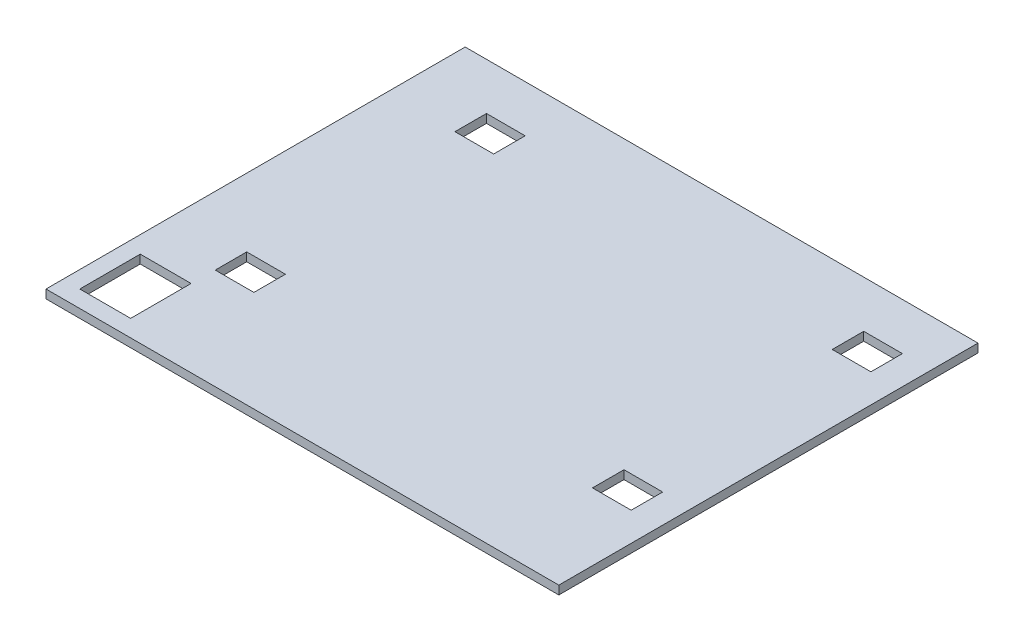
SolidWorks part; units mm, degrees
ref_plane "Front Plane" through (0, 0, 0) normal (0, 0, 1) x (1, 0, 0)
ref_plane "Top Plane" through (0, 0, 0) normal (0, 1, 0) x (1, 0, 0)
ref_plane "Right Plane" through (0, 0, 0) normal (1, 0, 0) x (0, 0, -1)
sketch "Sketch1" plane through (0, 0, 0) normal (0, 1, 0) x (1, 0, 0)
  line L1 (175, -175) -> (-175, -175)
  line L2 (175, -175) -> (175, 175)
  line L3 (175, 175) -> (-175, 175)
  line L4 (-175, -175) -> (-175, 175)
  line L5 (175, -175) -> (-175, 175) construction
  line L6 (175, 175) -> (-175, -175) construction
  point P0 (0, 0)
  dimension "D1" = 350
  dimension "D2" = 350
extrude "Boss-Extrude1" add sketch "Sketch1" along normal blind 6.35
sketch "Sketch2" plane through (0, 6.35, 0) normal (0, 1, 0) x (1, 0, 0)
  line L1 (100, -100) -> (-100, -100) construction
  line L2 (100, -100) -> (100, 100) construction
  line L3 (100, 100) -> (-100, 100) construction
  line L4 (-100, -100) -> (-100, 100) construction
  line L5 (100, -100) -> (-100, 100) construction
  line L6 (100, 100) -> (-100, -100) construction
  line L7 (-150, 95) -> (-75, 95) construction
  line L8 (-150, 95) -> (-150, 82.3) construction
  line L9 (-150, 82.3) -> (-75, 82.3) construction
  line L10 (-75, 95) -> (-75, 82.3) construction
  line L11 (-153.5, 100) -> (-125.5, 100) construction
  line L12 (-153.5, 100) -> (-153.5, 77.3) construction
  line L13 (-153.5, 77.3) -> (-125.5, 77.3) construction
  line L14 (-125.5, 100) -> (-125.5, 77.3) construction
  line L28 (-153.8, 100.3) -> (-125.2, 100.3)
  line L29 (-125.2, 100.3) -> (-125.2, 77)
  line L30 (-153.8, 77) -> (-125.2, 77)
  line L31 (-153.8, 100.3) -> (-153.8, 77)
  line L32 (-55, 0) -> (55, 0) construction
  line L33 (-153.8, -77) -> (-125.2, -77)
  line L34 (-125.2, -100.3) -> (-125.2, -77)
  line L35 (-153.8, -100.3) -> (-125.2, -100.3)
  line L36 (-153.8, -100.3) -> (-153.8, -77)
  line L37 (0, -55) -> (0, 55) construction
  line L38 (153.8, 100.3) -> (153.8, 77)
  line L39 (153.8, 100.3) -> (125.2, 100.3)
  line L40 (125.2, 100.3) -> (125.2, 77)
  line L41 (153.8, 77) -> (125.2, 77)
  line L42 (153.8, -100.3) -> (153.8, -77)
  line L43 (153.8, -100.3) -> (125.2, -100.3)
  line L44 (125.2, -100.3) -> (125.2, -77)
  line L45 (153.8, -77) -> (125.2, -77)
  circle A0 centre (-90.5, 88.65) radius 2 construction
  circle A1 centre (-80.5, 88.65) radius 2 construction
  circle A2 centre (-144.5, 88.65) radius 3 construction
  circle A3 centre (-134.5, 88.65) radius 3 construction
  point P0 (0, 0)
  point P16 (-150, 88.65)
  point P17 (-112.5, 95)
  point P25 (-139.5, 100)
  point P26 (-131.5, 88.65)
  point P27 (-147.5, 88.65)
  dimension "D8" = 4
  dimension "D10" = 4
  dimension "D13" = 6
  dimension "D14" = 6
  dimension "D1" = 200
  dimension "D2" = 200
  dimension "D3" = 75
  dimension "D4" = 12.7
  dimension "D5" = 5
  dimension "D6" = 9.5
  dimension "D7" = 22
  dimension "D9" = 32
  dimension "D11" = 22
  dimension "D12" = 32
  dimension "D15" = 5
  dimension "D16" = 6
  dimension "D17" = 6
  dimension "D18" = 0.3
extrude "Cut-Extrude1" cut sketch "Sketch2" against normal blind 10
sketch "Sketch3" plane through (0, 6.35, 0) normal (0, 1, 0) x (1, 0, 0)
  line L0 (-140.15, -117.8) -> (-140.15, -162.5) construction
  line L1 (100, -100) -> (-100, -100) construction
  line L2 (100, -100) -> (100, 100) construction
  line L3 (100, 100) -> (-100, 100) construction
  line L4 (-100, -100) -> (-100, 100) construction
  line L5 (100, -100) -> (-100, 100) construction
  line L6 (100, 100) -> (-100, -100) construction
  line L7 (-191.75, -117.8) -> (-154.15, -117.8)
  line L8 (-191.75, -117.8) -> (-191.75, -162.5)
  line L9 (-191.75, -162.5) -> (-154.15, -162.5)
  line L10 (-154.15, -117.8) -> (-154.15, -162.5)
  line L11 (-191.75, -117.8) -> (-154.15, -162.5) construction
  line L12 (-191.75, -162.5) -> (-154.15, -117.8) construction
  line L13 (-175, -175) -> (175, -175) construction
  line L14 (-175, 175) -> (-175, -175) construction
  point P0 (0, 0)
  point P6 (-172.95, -140.15)
  point P11 (-140.15, -140.15)
  dimension "D1" = 200
  dimension "D2" = 200
  dimension "D3" = 14
  dimension "D4" = 37.6
  dimension "D5" = 44.7
  dimension "D6" = 12.5
sketch "Sketch4" plane through (0, 6.35, 0) normal (0, 1, 0) x (1, 0, 0)
  line L0 (175, 175) -> (-175, 175) construction
  line L1 (-175, -175) -> (-204.25, -175)
  line L2 (-175, -175) -> (-175, 175)
  line L3 (-175, 175) -> (-204.25, 175)
  line L4 (-204.25, -175) -> (-204.25, 175)
  dimension "D1" = 29.25
extrude "Boss-Extrude2" add sketch "Sketch4" against normal up to surface (6.35 mm away)
extrude "Cut-Extrude2" cut sketch "Sketch3" against normal blind 45 contours L7 L10 L9 L8
sketch "Sketch5" plane through (0, 6.35, 0) normal (0, 1, 0) x (1, 0, 0)
  line L0 (175, -175) -> (175, 175) construction
  line L1 (-204.25, 175) -> (175, 175)
  line L2 (-204.25, 175) -> (-204.25, 135)
  line L3 (-204.25, 135) -> (175, 135)
  line L4 (175, 175) -> (175, 135)
  dimension "D1" = 40
extrude "Cut-Extrude3" cut sketch "Sketch5" against normal blind 10
